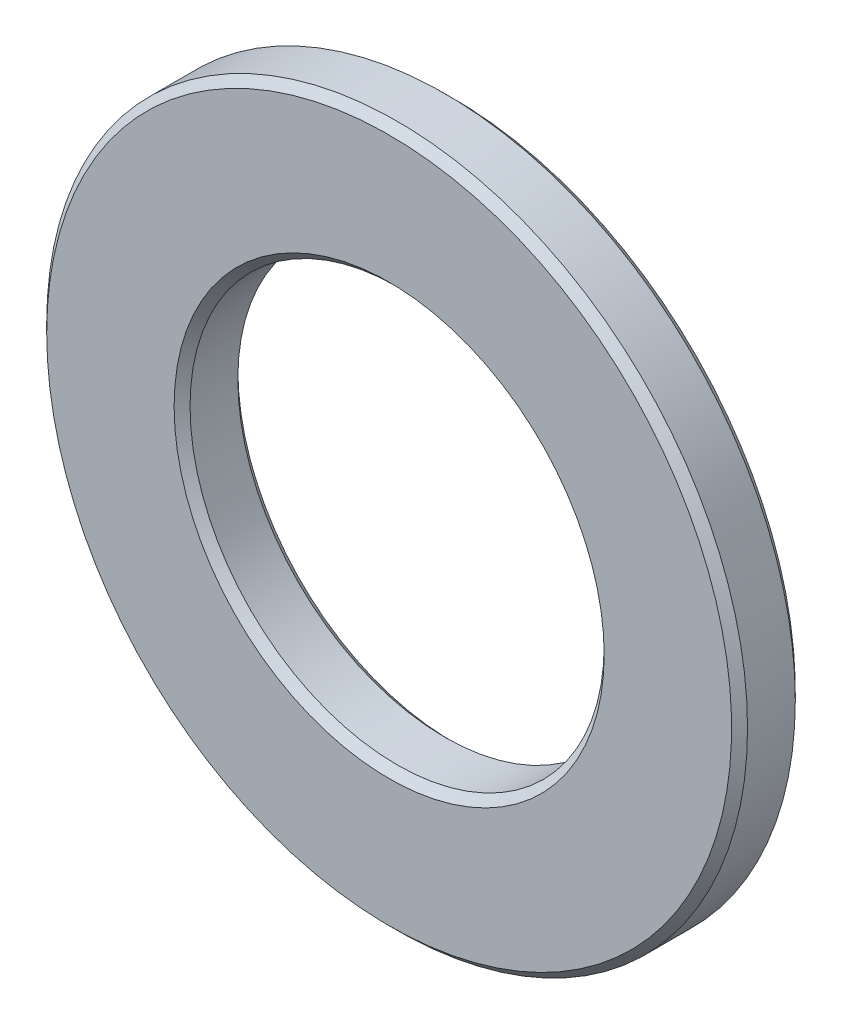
SolidWorks part; units mm, degrees
ref_plane "Front X-Y" through (0, 0, 0) normal (0, 0, 1) x (1, 0, 0)
ref_plane "Top X-Z" through (0, 0, 0) normal (0, 1, 0) x (1, 0, 0)
ref_plane "Right Y-Z" through (0, 0, 0) normal (1, 0, 0) x (0, 0, -1)
ref_plane "Plane1" through (0, 0, 0) normal (0, 1, 0) x (1, 0, 0)
sketch "Sketch1" plane through (0, 0, 0) normal (0, 1, 0) x (1, 0, 0)
  line L0 (0, 4) -> (21.5, 4)
  line L1 (21.5, 4) -> (22, 3.5)
  line L2 (22, 3.5) -> (22, 0.5)
  line L3 (22, 0.5) -> (21.5, 0)
  line L4 (21.5, 0) -> (0, 0)
  line L5 (0, 0) -> (0, 4)
  line L6 (0, 0) -> (0, 4) construction
revolve "Revolve1" add sketch "Sketch1" angle 360 about L6
ref_plane "Plane2" through (0, 0, 0) normal (0, 1, 0) x (1, 0, 0)
sketch "Sketch2" plane through (0, 0, 0) normal (0, 1, 0) x (1, 0, 0)
  line L0 (0, 4) -> (13.5, 4)
  line L1 (13.5, 4) -> (13, 3.5)
  line L2 (13, 3.5) -> (13, 0.5)
  line L3 (13, 0.5) -> (13.5, 0)
  line L4 (13.5, 0) -> (0, 0)
  line L5 (0, 0) -> (0, 4)
  line L6 (0, 0) -> (0, 4) construction
revolve "Cut-Revolve1" cut sketch "Sketch2" angle 360 about L6
